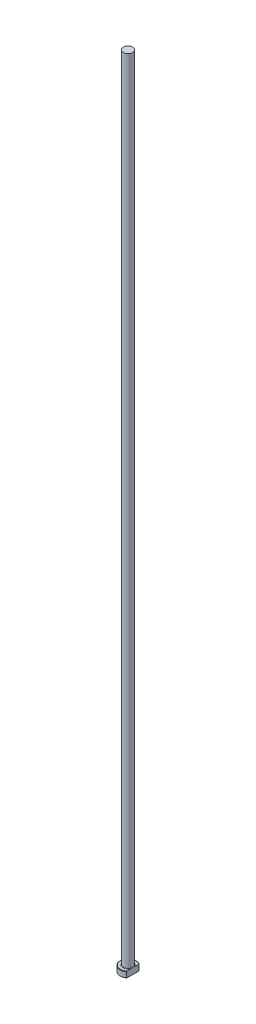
SolidWorks part; units mm, degrees
ref_plane "Front Plane" through (0, 0, 0) normal (0, 0, 1) x (1, 0, 0)
ref_plane "Top Plane" through (0, 0, 0) normal (0, 1, 0) x (1, 0, 0)
ref_plane "Right Plane" through (0, 0, 0) normal (1, 0, 0) x (0, 0, -1)
sketch "Sketch1" plane through (0, 0, 0) normal (0, 0, 1) x (1, 0, 0)
  line L0 (0, 259.9588) -> (0, -15.1925) construction
  line L1 (0, 0) -> (-4, 0)
  line L2 (-4, 0) -> (-4, 3)
  line L3 (-4, 3) -> (-2.35, 3)
  line L4 (-2.35, 3) -> (-2.35, 400)
  line L5 (-2.35, 400) -> (0, 400)
  line L6 (0, 400) -> (0, 0)
  dimension "L" = 400
  dimension "H" = 8
  dimension "T" = 3
  dimension "D" = 4.7
revolve "Revolve1" add sketch "Sketch1" angle 360 about L0
chamfer "Chamfer1" distance 0.2 angle 45 2 edges at (0, 3, 4) (0, 0, 4)
fillet "Fillet1" radius 0.2 1 edges at (0, 3, 2.35)
sketch "Sketch2" plane through (0, 0, 0) normal (0, 1, 0) x (1, 0, 0)
  line L0 (2.35, 3.2369) -> (2.35, -3.2369)
  circle A0 centre (0, 0) radius 4 construction
  arc A1 (2.35, -3.2369) -> (2.35, 3.2369) centre (0, 0) ccw
  circle A2 centre (0, 0) radius 2.35 construction
extrude "KEY" cut sketch "Sketch2" along normal through all
